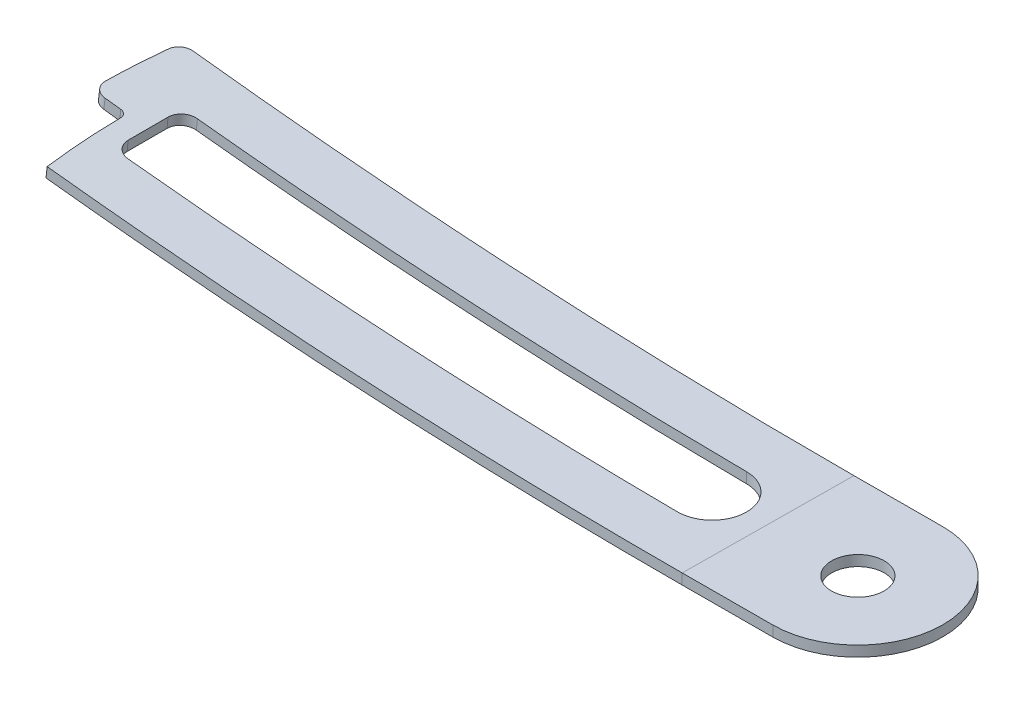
SolidWorks part; units mm, degrees
ref_plane "Спереди" through (0, 0, 0) normal (0, 0, 1) x (1, 0, 0)
ref_plane "Сверху" through (0, 0, 0) normal (0, 1, 0) x (1, 0, 0)
ref_plane "Справа" through (0, 0, 0) normal (1, 0, 0) x (0, 0, -1)
sketch "Эскиз1" plane through (0, 0, 0) normal (0, 1, 0) x (1, 0, 0)
  line L0 (0, 5.1435) -> (-45.4807, 5.1435)
  line L1 (-45.6814, 0) -> (-44.7181, 0)
  line L2 (0, -5.1435) -> (-44.0235, -5.1435)
  line L3 (0, 0) -> (-6.731, 0) construction
  line L4 (-8.8265, 2.0955) -> (-42.164, 2.0955)
  line L5 (-43.053, 1.2065) -> (-43.053, -1.2065)
  line L6 (-42.164, -2.0955) -> (-8.8265, -2.0955)
  circle A0 centre (0, 0) radius 1.5875
  arc A1 (0, -5.1435) -> (0, 5.1435) centre (0, 0) ccw
  arc A2 (-46.2709, 4.4253) -> (-46.475, 0.8075) centre (0, 0) ccw
  arc A3 (-44.3213, -0.3934) -> (-44.0235, -5.1435) centre (0, 0) ccw
  arc A4 (-8.8265, -2.0955) -> (-8.8265, 2.0955) centre (-8.8265, 0) ccw
  arc A5 (-45.4807, 5.1435) -> (-46.2709, 4.4253) centre (-45.4807, 4.3497) ccw
  arc A6 (-46.475, 0.8075) -> (-45.6814, 0) centre (-45.6814, 0.7937) ccw
  arc A7 (-44.7181, 0) -> (-44.3213, -0.3934) centre (-44.7181, -0.3969) cw
  arc A8 (-43.053, -1.2065) -> (-42.164, -2.0955) centre (-42.164, -1.2065) ccw
  arc A9 (-42.164, 2.0955) -> (-43.053, 1.2065) centre (-42.164, 1.2065) ccw
  point P21 (-44.323, 0)
  dimension "D1" = 3.175
  dimension "D2" = 46.482
  dimension "D3" = 44.323
  dimension "D8" = 0.7937
  dimension "D9" = 0.3969
  dimension "D10" = 0.889
  dimension "D4" = 10.287
  dimension "D5" = 36.322
  dimension "D6" = 6.731
  dimension "D7" = 4.191
extrude "Бобышка-Вытянуть1" add sketch "Эскиз1" along normal blind 0.635
other "Гибкие1" parameters "D0"=7, "D1"=0.3803, "D2"=10.5736
